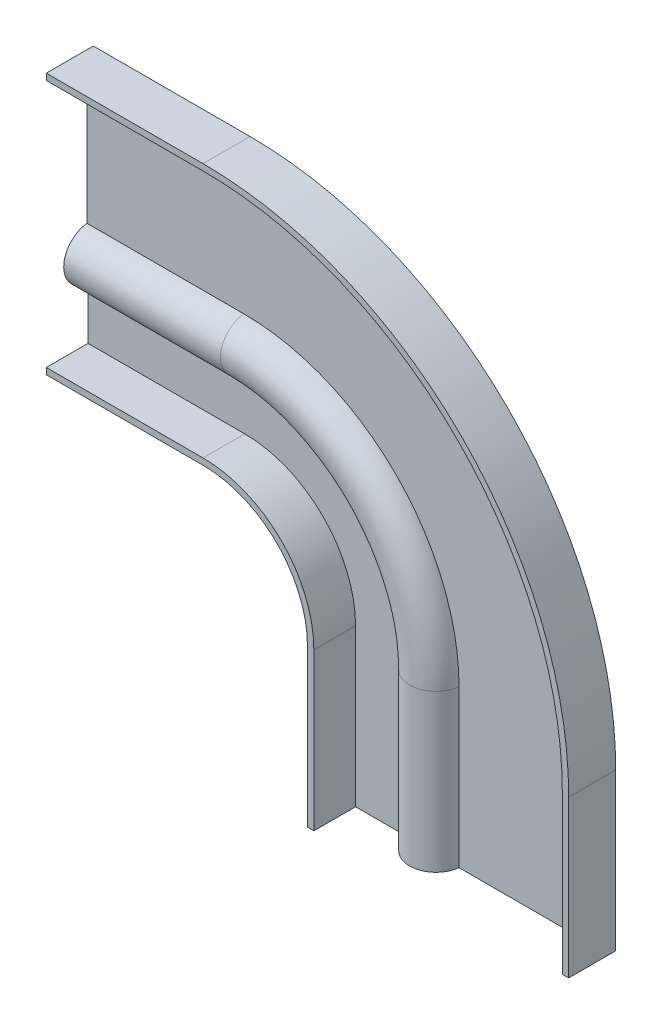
SolidWorks part; units mm, degrees
ref_plane "Front Plane" through (0, 0, 0) normal (0, 0, 1) x (1, 0, 0)
ref_plane "Top Plane" through (0, 0, 0) normal (0, 1, 0) x (1, 0, 0)
ref_plane "Right Plane" through (0, 0, 0) normal (1, 0, 0) x (0, 0, -1)
sketch "Sketch1" plane through (0, 0, 0) normal (0, 0, 1) x (1, 0, 0)
  line L0 (0, 0) -> (0, 50) construction
  line L1 (0, 50) -> (30, 50) construction
  line L2 (100, -20) -> (100, -50) construction
  line L3 (100, -50) -> (50, -50) construction
  line L4 (50, -50) -> (50, -20)
  line L5 (30, 0) -> (0, 0)
  arc A0 (30, 50) -> (100, -20) centre (30, -20) cw construction
  arc A1 (50, -20) -> (30, 0) centre (30, -20) ccw
  dimension "D2" = 50
  dimension "D3" = 20
  dimension "D1" = 30
sketch "Sketch2" plane through (0, 0, 0) normal (1, 0, 0) x (0, 0, -1)
  line L0 (-9, 50) -> (0, 50)
  line L1 (0, 0) -> (0, 12.4332)
  line L2 (-1.214, 48.786) -> (-1.214, 21.2235)
  line L3 (-9, 0) -> (0, 0)
  line L4 (0, 50) -> (0, -20) construction
  line L5 (0, 19.9948) -> (0, 50)
  line L6 (9, 50) -> (9, 48.786) construction
  line L7 (9, 48.786) -> (1.214, 48.786) construction
  line L8 (1.214, 11.3184) -> (1.214, 1.214) construction
  line L9 (1.214, 1.214) -> (9, 1.214) construction
  line L10 (9, 1.214) -> (9, 0) construction
  line L11 (1.214, 48.786) -> (1.214, 21.1096) construction
  line L12 (-9, 1.214) -> (-9, 0)
  line L13 (-1.0143, 1.214) -> (-9, 1.214)
  line L14 (-1.0143, 11.1847) -> (-1.0143, 1.214)
  line L15 (-9, 48.786) -> (-1.214, 48.786)
  line L16 (-9, 50) -> (-9, 48.786)
  line L17 (9, 50) -> (0, 50) construction
  line L18 (9, 0) -> (0, 0) construction
  arc A0 (0, 12.4332) -> (0, 19.9948) centre (0.1978, 16.214) ccw construction
  arc A1 (1.214, 21.1096) -> (1.214, 11.3184) centre (0.1978, 16.214) cw construction
  arc A2 (-1.214, 21.2235) -> (-1.0143, 11.1847) centre (-0.6175, 16.214) ccw
  arc A3 (0, 12.4332) -> (0, 19.9948) centre (-0.6175, 16.214) cw
  dimension "D6" = 5
  dimension "D5" = 15
  dimension "D8" = 1.214
  dimension "D7" = 15
  dimension "D10" = 1.214
  dimension "D1" = 9
  dimension "D2" = 1.214
  dimension "D3" = 1.214
  dimension "D4" = 1.214
  dimension "D9" = 50
  dimension "D11" = 1.214
sweep "Sweep1" add profiles "Sketch2" path "Sketch1"
